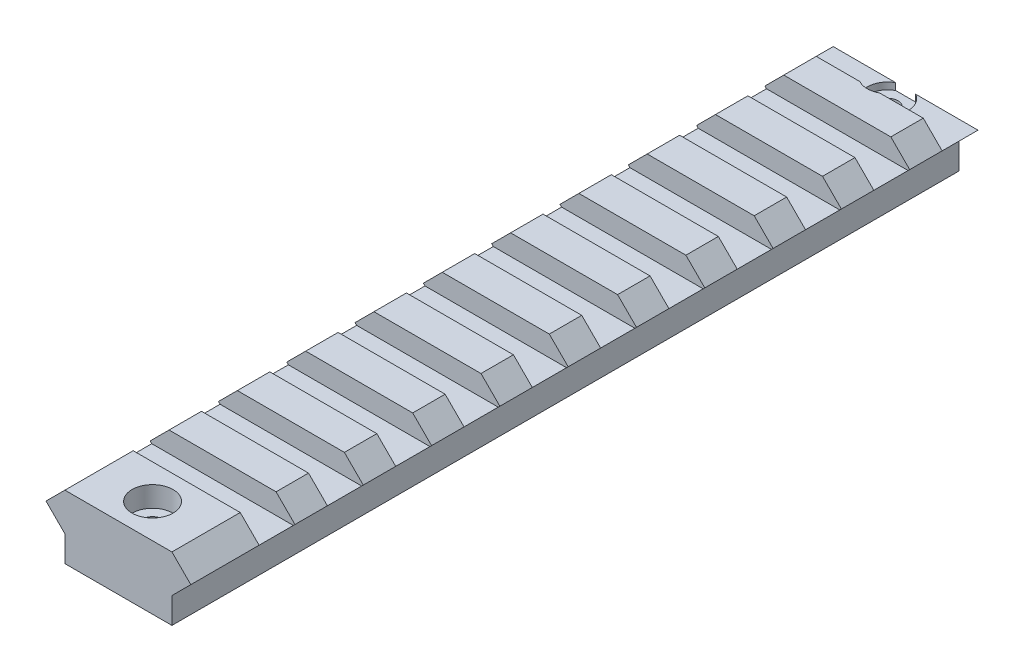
SolidWorks part; units mm, degrees
ref_plane "前视基准面" through (0, 0, 0) normal (0, 0, 1) x (1, 0, 0)
ref_plane "上视基准面" through (0, 0, 0) normal (0, 1, 0) x (1, 0, 0)
ref_plane "右视基准面" through (0, 0, 0) normal (1, 0, 0) x (0, 0, -1)
other "Configuration Table"
sketch "草图2" plane through (0, 0, 0) normal (0, 0, 1) x (1, 0, 0)
  line L0 (-26.0262, 29.9696) -> (-28.7912, 27.2046)
  line L1 (-28.7912, 29.9696) -> (-7.5912, 29.9696)
  line L2 (-28.7912, 29.9696) -> (-28.7912, 20.6496)
  line L3 (-28.7912, 20.6496) -> (-7.5912, 20.6496)
  line L4 (-7.5912, 29.9696) -> (-7.5912, 20.6496)
  line L5 (-28.7912, 29.9696) -> (-7.5912, 20.6496) construction
  line L6 (-28.7912, 20.6496) -> (-7.5912, 29.9696) construction
  line L7 (-26.0262, 20.6496) -> (-10.3562, 20.6496)
  line L8 (-26.0262, 20.6496) -> (-26.0262, 29.9696)
  line L9 (-26.0262, 29.9696) -> (-10.3562, 29.9696)
  line L10 (-10.3562, 20.6496) -> (-10.3562, 29.9696)
  line L11 (-26.0262, 20.6496) -> (-10.3562, 29.9696) construction
  line L12 (-26.0262, 29.9696) -> (-10.3562, 20.6496) construction
  line L13 (-28.7912, 27.2046) -> (-26.0262, 24.4396)
  line L14 (-18.1912, 29.9696) -> (-18.1912, 20.6496) construction
  line L15 (-7.5912, 27.2046) -> (-10.3562, 24.4396)
  line L16 (-10.3562, 29.9696) -> (-7.5912, 27.2046)
  point P0 (-18.1912, 25.3096)
  point P5 (-18.1912, 25.3096)
  dimension "D1" = 9.32
  dimension "D2" = 21.2
  dimension "D3" = 9.32
  dimension "D4" = 15.67
  dimension "D5" = 45
  dimension "D6" = 45
extrude "凸台-拉伸1" add sketch "草图2" along normal blind 110 contours L0 L13 L8 | L3 L10 L1 L8 | L16 L10 L15
sketch "草图3" plane through (0, 29.9696, 0) normal (0, 1, 0) x (1, 0, 0)
  line L1 (-28.7912, -4.75) -> (-7.5912, -4.75)
  line L2 (-28.7912, -4.75) -> (-28.7912, -10)
  line L3 (-28.7912, -10) -> (-7.5912, -10)
  line L4 (-7.5912, -4.75) -> (-7.5912, -10)
  line L6 (-28.7912, -14.75) -> (-28.7912, -20)
  line L7 (-26.0262, 0) -> (-10.3562, 0) construction
  line L8 (-28.7912, -14.75) -> (-7.5912, -14.75)
  line L9 (-7.5912, -14.75) -> (-7.5912, -20)
  line L10 (-28.7912, -20) -> (-7.5912, -20)
  line L11 (-28.7912, -24.75) -> (-28.7912, -30)
  line L12 (-28.7912, -24.75) -> (-7.5912, -24.75)
  line L13 (-7.5912, -24.75) -> (-7.5912, -30)
  line L14 (-28.7912, -30) -> (-7.5912, -30)
  line L15 (-28.7912, -34.75) -> (-28.7912, -40)
  line L16 (-28.7912, -34.75) -> (-7.5912, -34.75)
  line L17 (-7.5912, -34.75) -> (-7.5912, -40)
  line L18 (-28.7912, -40) -> (-7.5912, -40)
  line L19 (-28.7912, -44.75) -> (-28.7912, -50)
  line L20 (-28.7912, -44.75) -> (-7.5912, -44.75)
  line L21 (-7.5912, -44.75) -> (-7.5912, -50)
  line L22 (-28.7912, -50) -> (-7.5912, -50)
  line L23 (-28.7912, -54.75) -> (-28.7912, -60)
  line L24 (-28.7912, -54.75) -> (-7.5912, -54.75)
  line L25 (-7.5912, -54.75) -> (-7.5912, -60)
  line L26 (-28.7912, -60) -> (-7.5912, -60)
  line L27 (-28.7912, -64.75) -> (-28.7912, -70)
  line L28 (-28.7912, -64.75) -> (-7.5912, -64.75)
  line L29 (-7.5912, -64.75) -> (-7.5912, -70)
  line L30 (-28.7912, -70) -> (-7.5912, -70)
  line L31 (-28.7912, -74.75) -> (-28.7912, -80)
  line L32 (-28.7912, -74.75) -> (-7.5912, -74.75)
  line L33 (-7.5912, -74.75) -> (-7.5912, -80)
  line L34 (-28.7912, -80) -> (-7.5912, -80)
  line L35 (-28.7912, -84.75) -> (-28.7912, -90)
  line L36 (-28.7912, -84.75) -> (-7.5912, -84.75)
  line L37 (-7.5912, -84.75) -> (-7.5912, -90)
  line L38 (-28.7912, -90) -> (-7.5912, -90)
  line L39 (-28.7912, -94.75) -> (-28.7912, -100)
  line L40 (-28.7912, -94.75) -> (-7.5912, -94.75)
  line L41 (-7.5912, -94.75) -> (-7.5912, -100)
  line L42 (-28.7912, -100) -> (-7.5912, -100)
  line L43 (-18.1912, 0) -> (-18.1912, -22.7265) construction
  point P6 (-18.1912, -4.75)
  dimension "D1" = 5.25
  dimension "D2" = 10
  dimension "D4" = 21.2
  dimension "D3" = 10
extrude "切除-拉伸1" cut sketch "草图3" against normal blind 3
sketch "草图4" plane through (0, 29.9696, 0) normal (0, 1, 0) x (1, 0, 0)
  line L0 (-18.1912, -100) -> (-18.1912, -110) construction
  line L1 (-28.5562, -100) -> (-7.8262, -100) construction
  line L2 (-26.0262, -110) -> (-10.3562, -110) construction
  circle A0 centre (-18.1912, -105) radius 3
  dimension "D1" = 6
extrude "切除-拉伸2" cut sketch "草图4" against normal blind 3
sketch "草图5" plane through (0, 26.9696, 0) normal (0, 1, 0) x (1, 0, 0)
  circle A0 centre (-18.1912, -105) radius 1.5
  dimension "D1" = 3
extrude "切除-拉伸3" cut sketch "草图5" against normal through all
sketch "草图9" plane through (0, 0, 0) normal (0, 0, -1) x (-1, 0, 0)
  line L0 (7.5912, 27.2046) -> (10.3562, 24.4396) construction
  line L1 (7.5912, 27.2046) -> (10.3562, 24.4396)
  line L2 (28.7912, 27.2046) -> (26.0262, 24.4396) construction
  line L3 (28.7912, 27.2046) -> (26.0262, 24.4396)
  line L4 (10.3562, 24.4396) -> (26.0262, 24.4396)
  line L5 (7.5912, 27.2046) -> (28.7912, 27.2046)
extrude "凸台-拉伸2" add sketch "草图9" along normal blind 5.25
sketch "草图10" plane through (0, 0, 0) normal (0, 0, -1) x (-1, 0, 0)
  line L4 (26.0262, 24.4396) -> (10.3562, 24.4396)
  line L5 (10.3562, 24.4396) -> (10.3562, 20.6496)
  line L6 (10.3562, 20.6496) -> (26.0262, 20.6496)
  line L7 (26.0262, 20.6496) -> (26.0262, 24.4396)
  line L8 (26.0262, 24.4396) -> (10.3562, 24.4396)
  line L9 (10.3562, 24.4396) -> (10.3562, 20.6496)
  line L10 (10.3562, 20.6496) -> (26.0262, 20.6496)
  line L11 (26.0262, 20.6496) -> (26.0262, 24.4396)
  dimension "D1" = 0
extrude "凸台-拉伸3" add sketch "草图10" along normal up to vertex
sketch "草图13" plane through (0, 0, -5.25) normal (0, 0, -1) x (-1, 0, 0)
  line L1 (18.1912, 27.2046) -> (18.1912, 20.6496) construction
  line L3 (10.3562, 20.6496) -> (26.0262, 20.6496) construction
  line L4 (28.7912, 27.2046) -> (7.5912, 27.2046) construction
  line L5 (18.1912, 23.9271) -> (23.1912, 23.9271) construction
  line L6 (18.1912, 23.9271) -> (13.2546, 23.9271) construction
  line L7 (14.1912, 25.4271) -> (13.2546, 23.9271)
  line L8 (13.1954, 22.4271) -> (23.1871, 22.4271)
  line L9 (13.1954, 22.4271) -> (13.1954, 25.4271)
  line L10 (13.1954, 25.4271) -> (23.1871, 25.4271)
  line L11 (23.1871, 22.4271) -> (23.1871, 25.4271)
  line L12 (13.1954, 22.4271) -> (23.1871, 25.4271) construction
  line L13 (13.1954, 25.4271) -> (23.1871, 22.4271) construction
  line L14 (13.1954, 22.4271) -> (23.1912, 22.4271)
  line L15 (13.1954, 22.4271) -> (13.1954, 20.6496)
  line L16 (13.1954, 20.6496) -> (23.1912, 20.6496)
  line L17 (23.1912, 22.4271) -> (23.1912, 20.6496)
  line L18 (13.2546, 23.9271) -> (14.1912, 22.4271)
  line L19 (23.1279, 23.9271) -> (22.1912, 22.4271)
  line L20 (22.1912, 25.4271) -> (23.1279, 23.9271)
  point P17 (18.1912, 25.4271)
  dimension "D1" = 5
  dimension "D2" = 4.9367
  dimension "D3" = 3
  dimension "D4" = 9.9916
  dimension "D5" = 4
extrude "切除-拉伸9" cut sketch "草图13" against normal blind 15 contours L20 L10 L7 L18 L14 L19 | L17 L14 L8 L15 M15
chamfer "倒角1" distance 1 angle 45 7 edges at (-22.6912, 22.4271, -5.25) (-23.1912, 22.4271, 2.25) (-13.6933, 22.4271, -5.25) (-13.1954, 22.4271, 2.25) (-14.1912, 22.4271, 2.25) (-22.6912, 22.4271, 9.75) (-13.6933, 22.4271, 9.75)
sketch "草图15" plane through (0, 0, -5.25) normal (0, 0, -1) x (-1, 0, 0)
  line L0 (10.3562, 22.5446) -> (12.3562, 22.5446) construction
  line L1 (10.3562, 24.4396) -> (10.3562, 20.6496) construction
  line L2 (26.0262, 22.5446) -> (24.0262, 22.5446) construction
  line L3 (26.0262, 20.6496) -> (26.0262, 24.4396) construction
  circle A0 centre (12.3562, 22.5446) radius 1
  circle A1 centre (24.0262, 22.5446) radius 1
  dimension "D2" = 2
  dimension "D3" = 2
  dimension "D4" = 2
  dimension "D1" = 2
extrude "切除-拉伸10" cut sketch "草图15" against normal blind 5
sketch "草图17" plane through (0, 27.2046, 0) normal (0, 1, 0) x (1, 0, 0)
  line L0 (-18.1912, 0) -> (-18.1912, 5.25) construction
  line L1 (-26.0262, 0) -> (-10.3562, 0) construction
  line L2 (-28.7912, 5.25) -> (-7.5912, 5.25) construction
  circle A0 centre (-18.1912, 2.625) radius 1.5
  dimension "D1" = 3
extrude "切除-拉伸11" cut sketch "草图17" against normal through all
sketch "草图18" plane through (0, 27.2046, 0) normal (0, 1, 0) x (1, 0, 0)
  circle A0 centre (-18.1912, 2.625) radius 3
  dimension "D1" = 6
extrude "切除-拉伸12" cut sketch "草图18" against normal blind 1 and the other way through all
